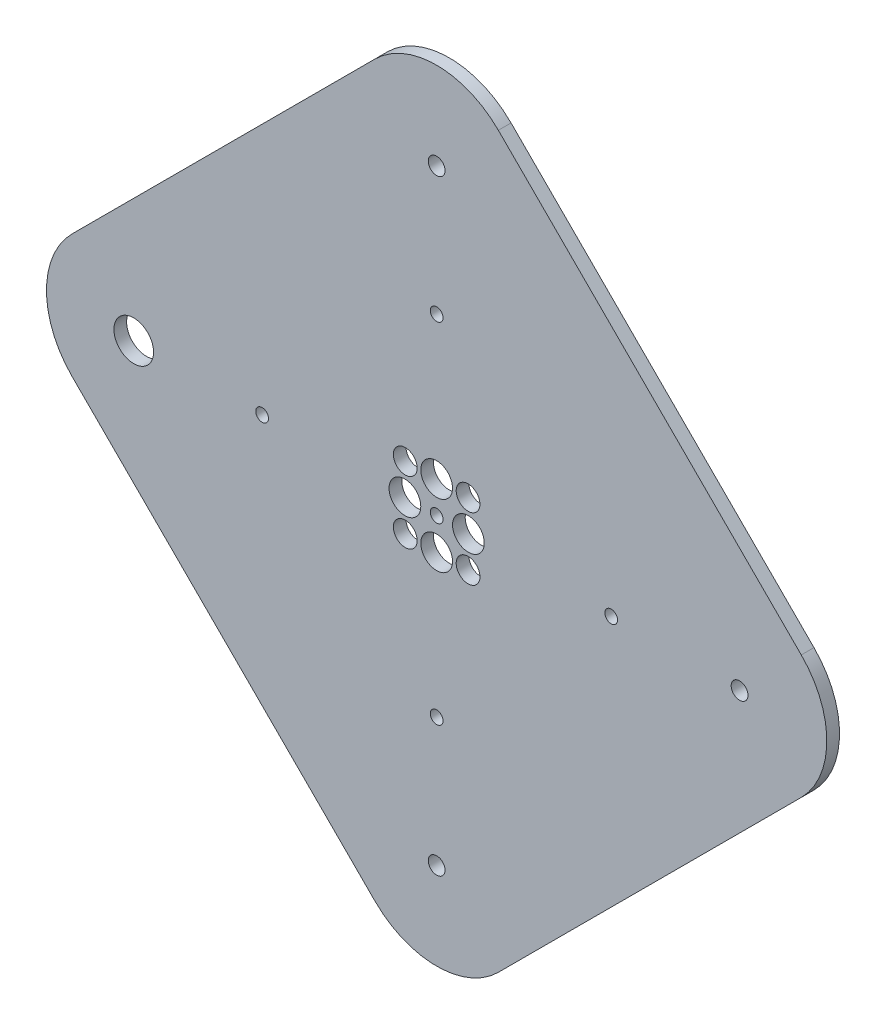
SolidWorks part; units mm, degrees
ref_plane "Plane1" through (0, 0, 0) normal (0, 0, 1) x (1, 0, 0)
ref_plane "Plane2" through (0, 0, 0) normal (0, 1, 0) x (1, 0, 0)
ref_plane "Plane3" through (0, 0, 0) normal (1, 0, 0) x (0, 0, -1)
sketch "Sketch19" plane through (0, 0, 0) normal (0, 0, 1) x (1, 0, 0)
  line L0 (-145.9292, -24.6957) -> (-24.6957, -145.9292)
  line L1 (24.6957, -145.9292) -> (145.9292, -24.6957)
  line L2 (145.9292, 24.6957) -> (24.6957, 145.9292)
  line L3 (-24.6957, 145.9292) -> (-145.9292, 24.6957)
  line L4 (85.3124, 85.3124) -> (-85.3124, -85.3124) construction
  line L5 (-85.3124, 85.3124) -> (0, 0) construction
  line L6 (0, 0) -> (85.3124, -85.3124) construction
  line L7 (5.5626, 0) -> (0, 0) construction
  arc A0 (-145.9292, 24.6957) -> (-145.9292, -24.6957) centre (-121.2335, 0) ccw
  arc A1 (-24.6957, -145.9292) -> (24.6957, -145.9292) centre (0, -121.2335) ccw
  arc A2 (145.9292, -24.6957) -> (145.9292, 24.6957) centre (121.2335, 0) ccw
  arc A3 (24.6957, 145.9292) -> (-24.6957, 145.9292) centre (0, 121.2335) ccw
  dimension "D1" = 34.925
  dimension "D2" = 85.3124
extrude "Boss-Extrude2" add sketch "Sketch19" along normal blind 5.08 contours L0 A1 L1 A2 L2 A3 L3 A0
sketch "Sketch21" plane through (0, 0, 5.08) normal (0, 0, 1) x (1, 0, 0)
  circle A0 centre (0, 0) radius 31.75
  circle A1 centre (0, 0) radius 25.4
  dimension "D1" = 6.35
  dimension "D2" = 63.5
sketch "Sketch22" plane through (0, 0, 5.08) normal (0, 0, 1) x (1, 0, 0)
  line L0 (0, 0) -> (0, 12.7) construction
  line L1 (0, -12.7) -> (0, 0) construction
  circle A0 centre (0, 12.7) radius 6.35
  circle A1 centre (12.7, 0) radius 6.35
  circle A2 centre (0, -12.7) radius 6.35
  circle A3 centre (-12.7, 0) radius 6.35
  point P13 (0, 0)
  dimension "D1" = 12.7
  dimension "D2" = 12.7
  dimension "D4" = 25.4
  dimension "D3" = 4
extrude "Cut-Extrude4" cut sketch "Sketch22" against normal through all
sketch "Sketch23" plane through (0, 0, 5.08) normal (0, 0, 1) x (1, 0, 0)
  point P0 (0, 0)
hole_wizard "1/4-20 Tapped Hole1" positions "3DSketch1" profile "Sketch24" tap size "1/4-20" standard "ANSI Inch"
sketch3d "3DSketch1"
  point P0 (0, 0, 5.08)
sketch "Sketch24" plane through (0, 0, 5.08) normal (1, 0, 0) x (0, -1, 0)
  line L0 (0, 0) -> (0, 11.0588)
  line L1 (0, 11.0588) -> (2.5527, 9.525)
  line L2 (2.5527, 9.525) -> (2.5527, 0)
  line L5 (2.5527, 0) -> (0, 0)
  line L10 (0, 11.0588) -> (-2.5527, 9.525) construction
  line L11 (0, -6.35) -> (0, 107.95) construction
  dimension "Tap Drill Dia." = 5.1054
  dimension "Tap Drill Depth" = 9.525
  dimension "Drill Angle" = 118
sketch "Sketch25" plane through (0, 0, 5.08) normal (0, 0, 1) x (1, 0, 0)
  line L0 (0, 0) -> (-12.5724, 12.5724) construction
  line L1 (0, 0) -> (0, 19.05) construction
  line L2 (0, 0) -> (12.5724, -12.5724) construction
  circle A0 centre (-12.5724, 12.5724) radius 4.7625
  circle A1 centre (0, 12.7) radius 6.35 construction
  circle A2 centre (12.5724, 12.5724) radius 4.7625
  circle A3 centre (12.5724, -12.5724) radius 4.7625
  circle A4 centre (-12.5724, -12.5724) radius 4.7625
  point P17 (0, 0)
  dimension "D3" = 9.525
  dimension "D2" = 45
  dimension "D5" = 12.5724
  dimension "D4" = 4
extrude "Cut-Extrude5" cut sketch "Sketch25" against normal through all contours A4
sketch "Sketch26" plane through (0, 0, 5.08) normal (0, 0, 1) x (1, 0, 0)
  circle A0 centre (-121.2335, 0) radius 7.9375
  circle A1 centre (0, 121.2335) radius 3.3655
  circle A2 centre (121.2335, 0) radius 3.3655
  circle A3 centre (0, -121.2335) radius 3.3655
  arc A4 (-145.9292, 24.6957) -> (-145.9292, -24.6957) centre (-121.2335, 0) ccw construction
  arc A5 (-24.6957, -145.9292) -> (24.6957, -145.9292) centre (0, -121.2335) ccw construction
  arc A6 (145.9292, -24.6957) -> (145.9292, 24.6957) centre (121.2335, 0) ccw construction
  arc A7 (24.6957, 145.9292) -> (-24.6957, 145.9292) centre (0, 121.2335) ccw construction
  dimension "D1" = 15.875
  dimension "D2" = 6.731
  dimension "D3" = 6.731
  dimension "D4" = 6.731
extrude "Cut-Extrude6" cut sketch "Sketch26" against normal through all
sketch "Sketch27" plane through (0, 0, 5.08) normal (0, 0, 1) x (1, 0, 0)
  line L0 (0, 0) -> (0, 69.85) construction
  line L1 (0, 0) -> (69.85, 0) construction
  line L2 (0, 0) -> (0, -69.85) construction
  line L3 (0, 0) -> (-69.85, 0) construction
  circle A0 centre (0, 0) radius 82.55 construction
  point P10 (0, 0)
  dimension "D1" = 165.1
  dimension "D2" = 69.85
  dimension "D3" = 4
hole_wizard "1/4-20 Tapped Hole2" positions "Sketch28" profile "Sketch29" tap size "1/4-20" standard "ANSI Inch"
sketch "Sketch28" plane through (0, 0, 5.08) normal (0, 0, 1) x (1, 0, 0)
  point P0 (0, 69.85)
  point P3 (69.85, 0)
  point P6 (0, -69.85)
  point P9 (-69.85, 0)
sketch "Sketch29" plane through (0, 69.85, 5.08) normal (1, 0, 0) x (0, -1, 0)
  line L0 (0, 0) -> (0, 5.08)
  line L1 (0, 5.08) -> (2.5527, 5.08)
  line L2 (2.5527, 5.08) -> (2.5527, 0)
  line L5 (2.5527, 0) -> (0, 0)
  line L11 (0, -6.35) -> (0, 107.95) construction
  dimension "Thru Tap Drill Dia." = 5.1054
  dimension "Thru Tap Drill Depth" = 5.08
